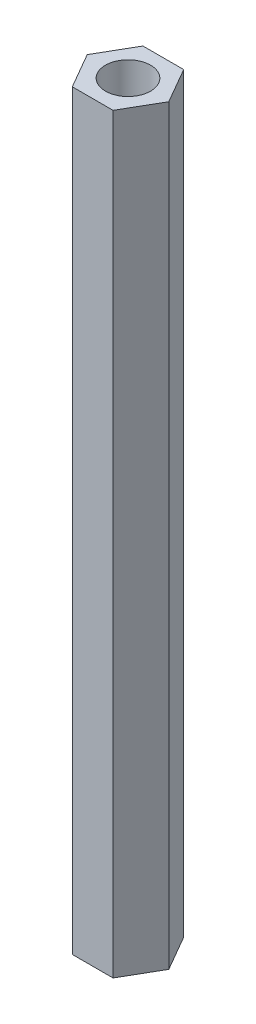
SolidWorks part; units mm, degrees
ref_plane "Front Plane" through (0, 0, 0) normal (0, 0, 1) x (1, 0, 0)
ref_plane "Top Plane" through (0, 0, 0) normal (0, 1, 0) x (1, 0, 0)
ref_plane "Right Plane" through (0, 0, 0) normal (1, 0, 0) x (0, 0, -1)
sketch "Sketch1" plane through (0, 0, 0) normal (0, 1, 0) x (1, 0, 0)
  line L1 (1.3568, -2.35) -> (2.7135, 0)
  line L2 (2.7135, 0) -> (1.3568, 2.35)
  line L3 (1.3568, 2.35) -> (-1.3568, 2.35)
  line L4 (-1.3568, 2.35) -> (-2.7135, 0)
  line L5 (-2.7135, 0) -> (-1.3568, -2.35)
  line L6 (-1.3568, -2.35) -> (1.3568, -2.35)
  circle A0 centre (0, 0) radius 1.5
  circle A1 centre (0, 0) radius 2.35 construction
  dimension "D2" = 3
  dimension "D1" = 4.7
extrude "Boss-Extrude1" add sketch "Sketch1" along normal blind 50
